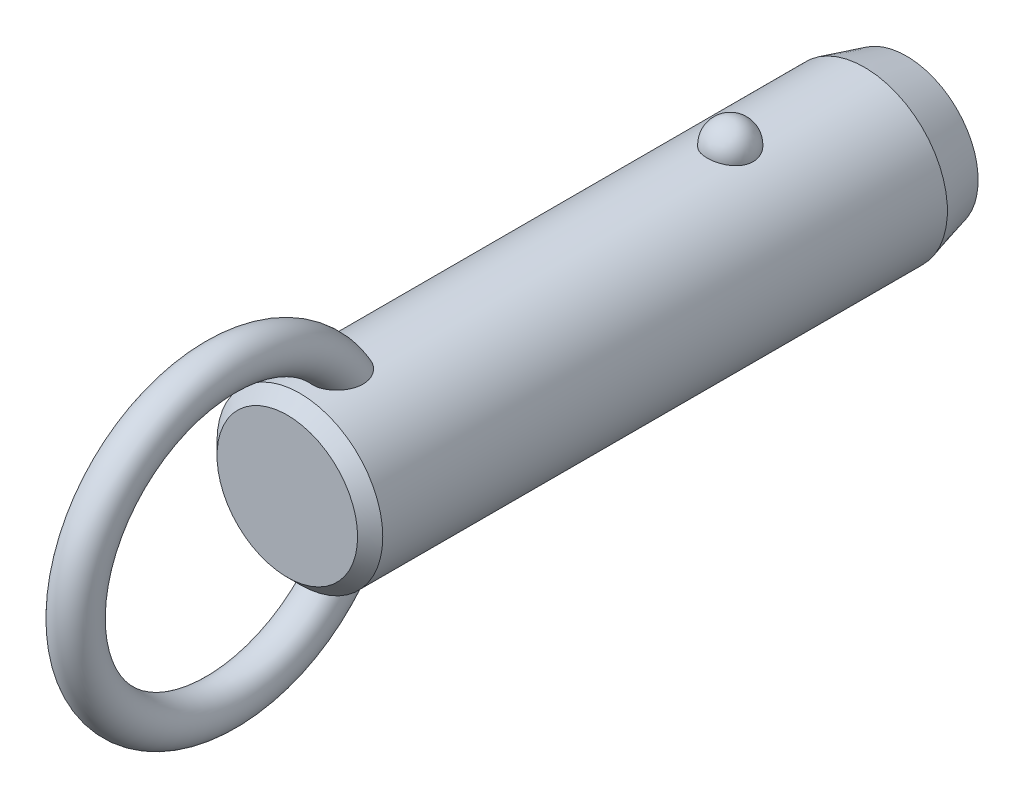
SolidWorks part; units mm, degrees
ref_plane "Front Plane" through (0, 0, 0) normal (0, 0, 1) x (1, 0, 0)
ref_plane "Top Plane" through (0, 0, 0) normal (0, 1, 0) x (1, 0, 0)
ref_plane "Right Plane" through (0, 0, 0) normal (1, 0, 0) x (0, 0, -1)
sketch "Sketch2" plane through (0, 0, 0) normal (0, 0, 1) x (1, 0, 0)
  circle A0 centre (0, 0) radius 7.9
  point P3 (0, 7.9)
  dimension "D1" = 15.8
extrude "Boss-Extrude1" add sketch "Sketch2" along normal blind 30.5
sketch "Sketch3" plane through (0, 0, 0) normal (0, 0, -1) x (-1, 0, 0)
  circle A0 centre (0, 0) radius 7.9
  dimension "D1" = 15.8
extrude "Boss-Extrude2" add sketch "Sketch3" along normal blind 19
chamfer "Chamfer1" distance 4 angle 15 1 edges at (-7.9, 0, -19)
sketch "Sketch12" plane through (0, 0, 0) normal (1, 0, 0) x (0, 0, -1)
  line L0 (-30.5, 7.9) -> (-30.5, -7.9) construction
  point P0 (-30.5, 0)
sketch "Sketch13" plane through (0, 0, 0) normal (1, 0, 0) x (0, 0, -1)
  circle A0 centre (-46.35, 0) radius 15.85
  point P2 (-30.5, 0)
  dimension "D1" = 31.7
sketch "Sketch14" plane through (0, 0, 0) normal (0, 1, 0) x (1, 0, 0)
  circle A0 centre (0, -32.5) radius 2
  point P2 (0, -30.5)
  dimension "D1" = 4
sweep "Sweep1" add profiles "Sketch14" path "Sketch13"
sketch "Sketch15" plane through (0, 0, 30.5) normal (0, 0, 1) x (1, 0, 0)
  circle A0 centre (0, 0) radius 7.9
  dimension "D1" = 15.8
extrude "Boss-Extrude3" add sketch "Sketch15" along normal blind 9.52
chamfer "Chamfer2" distance 1.2 angle 45 1 edges at (7.9, 0, 40.02)
sketch "Sketch18" plane through (0, 0, 0) normal (1, 0, 0) x (0, 0, -1)
  line L0 (15, 7.9) -> (-32.6091, 7.9) construction
  line L1 (2.2, 10.1) -> (2.2, 5.7)
  line L2 (-32.6091, -7.9) -> (15, -7.9) construction
  arc A0 (2.2, 10.1) -> (2.2, 5.7) centre (2.2, 7.9) ccw
  point P4 (0, 7.9)
  dimension "D1" = 18
revolve "Revolve1" add sketch "Sketch18" angle 360 about L1
